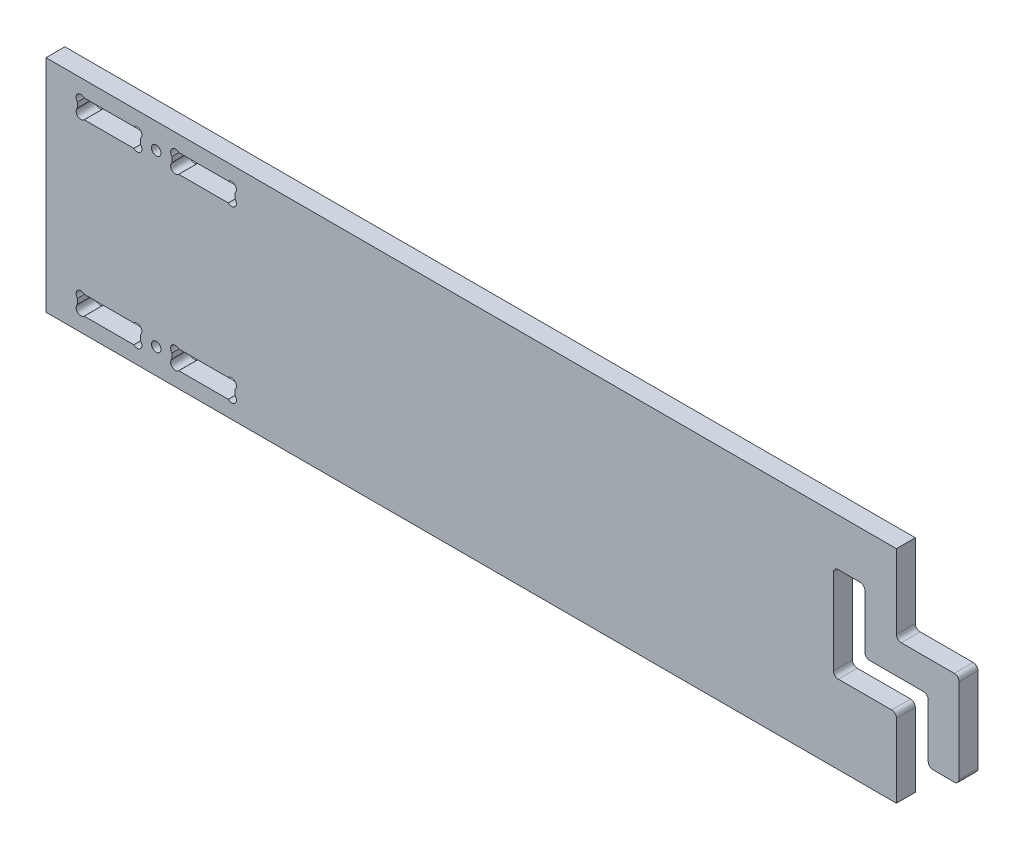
SolidWorks part; units mm, degrees
ref_plane "Plan de face" through (0, 0, 0) normal (0, 0, 1) x (1, 0, 0)
ref_plane "Plan de dessus" through (0, 0, 0) normal (0, 1, 0) x (1, 0, 0)
ref_plane "Plan de droite" through (0, 0, 0) normal (1, 0, 0) x (0, 0, -1)
sketch "Esquisse1" plane through (0, 0, 0) normal (0, 0, 1) x (1, 0, 0)
  line L0 (-45.9901, 0) -> (610, 0) construction
  line L1 (0, -10.8988) -> (0, 88.988) construction
  line L2 (-26.8353, 35) -> (563.8153, 35) construction
  line L3 (540, -14.5792) -> (540, 103.1648) construction
  line L4 (70, -14.5792) -> (70, 81.2288) construction
  line L5 (556.7776, 70) -> (-35.8573, 70) construction
  line L6 (270, 111.1569) -> (270, -79.3002) construction
  line L7 (37.3695, 5) -> (-4.5443, 5) construction
  line L8 (35, 42.5386) -> (35, -10.8988) construction
  line L9 (-2.1638, 11) -> (33.2886, 11) construction
  line L10 (20, -18.0393) -> (20, 19.1034) construction
  line L11 (10, 5) -> (12.2398, 7.2398) construction
  line L12 (57.8504, 11) -> (42.1496, 11)
  line L13 (-1.4837, 8) -> (36.3492, 8) construction
  line L14 (12.1496, 11) -> (27.8504, 11)
  line L15 (30, 12.2636) -> (30, -2.6145) construction
  line L16 (10, 8.8504) -> (10, 7.1496)
  line L17 (10, -2.6145) -> (10, 13.2839) construction
  line L18 (12.1496, 5) -> (27.8504, 5)
  line L19 (30, 8.8504) -> (30, 7.1496)
  line L20 (40, 8.8504) -> (40, 7.1496)
  line L21 (57.8504, 5) -> (42.1496, 5)
  line L22 (60, 8.8504) -> (60, 7.1496)
  line L23 (60, 61.1496) -> (60, 62.8504)
  line L24 (57.8504, 65) -> (42.1496, 65)
  line L25 (40, 61.1496) -> (40, 62.8504)
  line L26 (57.8504, 59) -> (42.1496, 59)
  line L27 (30, 61.1496) -> (30, 62.8504)
  line L28 (12.1496, 65) -> (27.8504, 65)
  line L29 (12.1496, 59) -> (27.8504, 59)
  line L30 (10, 61.1496) -> (10, 62.8504)
  line L31 (260, 75.8562) -> (260, -10.8988) construction
  line L32 (282.1392, 24.9) -> (240, 24.9) construction
  line L33 (280.1, -10.8988) -> (280.1, 75.8562) construction
  line L34 (275.7806, 15) -> (294.0933, 15) construction
  line L35 (289.9, 75.8562) -> (289.9, -14.5792) construction
  line L36 (255.9418, 44.9) -> (300, 44.9) construction
  line L37 (250, -14.5792) -> (250, 79.417) construction
  line L38 (246.0225, 55) -> (262.4276, 55) construction
  line L39 (270, 70) -> (270, 46.43)
  line L40 (271.53, 44.9) -> (288.39, 44.9)
  line L41 (289.9, 43.39) -> (289.9, 16.51)
  line L42 (288.39, 15) -> (281.61, 15)
  line L43 (280.1, 16.51) -> (280.1, 33.47)
  line L44 (278.57, 35) -> (261.51, 35)
  line L45 (260, 36.51) -> (260, 53.47)
  line L46 (258.47, 55) -> (251.53, 55)
  line L47 (250, 53.47) -> (250, 26.43)
  line L48 (251.53, 24.9) -> (268.49, 24.9)
  line L49 (270, 23.39) -> (270, 0)
  line L50 (270, 70) -> (0, 70)
  line L51 (0, 70) -> (0, 0)
  line L52 (0, 0) -> (270, 0)
  arc A0 (10, 7.1496) -> (12.1496, 5) centre (11.0748, 6.0748) ccw
  arc A1 (10, 8.8504) -> (12.1496, 11) centre (11.0748, 9.9252) cw
  arc A2 (30, 7.1496) -> (27.8504, 5) centre (28.9252, 6.0748) cw
  arc A3 (30, 8.8504) -> (27.8504, 11) centre (28.9252, 9.9252) ccw
  arc A4 (40, 8.8504) -> (42.1496, 11) centre (41.0748, 9.9252) cw
  arc A5 (40, 7.1496) -> (42.1496, 5) centre (41.0748, 6.0748) ccw
  arc A6 (60, 7.1496) -> (57.8504, 5) centre (58.9252, 6.0748) cw
  arc A7 (60, 8.8504) -> (57.8504, 11) centre (58.9252, 9.9252) ccw
  arc A8 (60, 61.1496) -> (57.8504, 59) centre (58.9252, 60.0748) cw
  arc A9 (60, 62.8504) -> (57.8504, 65) centre (58.9252, 63.9252) ccw
  arc A10 (40, 62.8504) -> (42.1496, 65) centre (41.0748, 63.9252) cw
  arc A11 (40, 61.1496) -> (42.1496, 59) centre (41.0748, 60.0748) ccw
  arc A12 (30, 62.8504) -> (27.8504, 65) centre (28.9252, 63.9252) ccw
  arc A13 (30, 61.1496) -> (27.8504, 59) centre (28.9252, 60.0748) cw
  arc A14 (10, 61.1496) -> (12.1496, 59) centre (11.0748, 60.0748) ccw
  arc A15 (10, 62.8504) -> (12.1496, 65) centre (11.0748, 63.9252) cw
  arc A16 (289.9, 16.51) -> (288.39, 15) centre (288.39, 16.51) cw
  arc A17 (281.61, 15) -> (280.1, 16.51) centre (281.61, 16.51) cw
  arc A18 (288.39, 44.9) -> (289.9, 43.39) centre (288.39, 43.39) cw
  arc A19 (261.51, 35) -> (260, 36.51) centre (261.51, 36.51) cw
  arc A20 (268.49, 24.9) -> (270, 23.39) centre (268.49, 23.39) cw
  arc A21 (260, 53.47) -> (258.47, 55) centre (258.47, 53.47) ccw
  arc A22 (251.53, 55) -> (250, 53.47) centre (251.53, 53.47) ccw
  arc A23 (250, 26.43) -> (251.53, 24.9) centre (251.53, 26.43) ccw
  arc A24 (280.1, 33.47) -> (278.57, 35) centre (278.57, 33.47) ccw
  arc A25 (270, 46.43) -> (271.53, 44.9) centre (271.53, 46.43) ccw
  circle A26 centre (35, 8) radius 1.5
  circle A27 centre (35, 62) radius 1.5
  dimension "D1" = 45
  dimension "D2" = 1.51
  dimension "D3" = 1.53
extrude "Extrusion1" add sketch "Esquisse1" along normal blind 6
